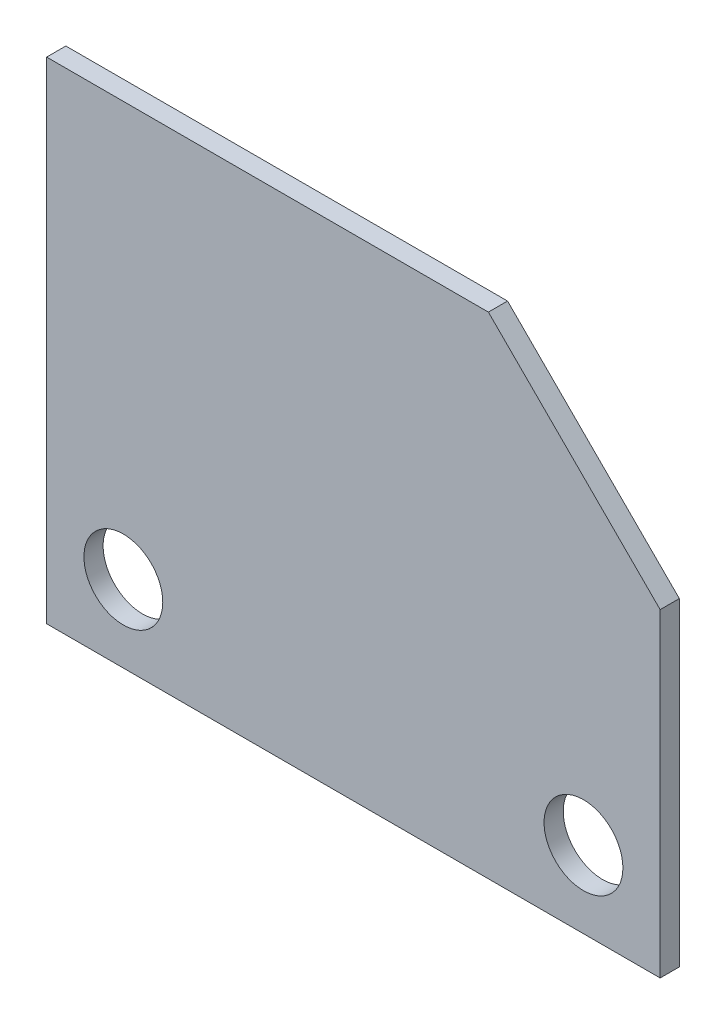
SolidWorks part; units mm, degrees
ref_plane "Front" through (0, 0, 0) normal (0, 0, 1) x (1, 0, 0)
ref_plane "Top" through (0, 0, 0) normal (0, 1, 0) x (1, 0, 0)
ref_plane "Right" through (0, 0, 0) normal (1, 0, 0) x (0, 0, -1)
sketch "Sketch1" plane through (0, 0, 0) normal (0, 0, 1) x (1, 0, 0)
  line L1 (-12.7, 20.32) -> (12.7, 20.32)
  line L2 (-12.7, 20.32) -> (-12.7, 0)
  line L3 (-12.7, 0) -> (12.7, 0)
  line L4 (12.7, 20.32) -> (12.7, 0)
  point P4 (0, 0)
  dimension "D1" = 25.4
  dimension "D2" = 20.32
extrude "Extrude1" add sketch "Sketch1" along normal blind 0.7937
hole_wizard "#30 (0.128500) Diameter Hole1" positions "3DSketch1" profile "Sketch2" hole size "#30" standard "Ansi Inch"
sketch3d "3DSketch1"
  circle A0 centre (9.525, 3.175, 0.7938) radius 1.6319 construction
  circle A1 centre (-9.525, 3.175, 0.7938) radius 1.6319 construction
  point P0 (-9.525, 3.175, 0.7937)
  point P1 (9.525, 3.175, 0.7937)
  point P4 (9.525, 3.175, 2.4257)
  point P7 (-9.525, 3.175, 2.4257)
sketch "Sketch2" plane through (-9.525, 3.175, 0.7937) normal (1, 0, 0) x (0, -1, 0)
  line L0 (0, 0) -> (0, 0.7938)
  line L1 (0, 0.7938) -> (1.6319, 0.7938)
  line L2 (1.6319, 0.7938) -> (1.6319, 0)
  line L5 (1.6319, 0) -> (0, 0)
  line L11 (0, -6.35) -> (0, 107.95) construction
  dimension "Thru Hole Dia." = 3.2639
  dimension "Thru Hole Depth" = 0.7937
chamfer "Chamfer1" distance 7.112 angle 45 1 edges at (12.7, 20.32, 0.3969)
